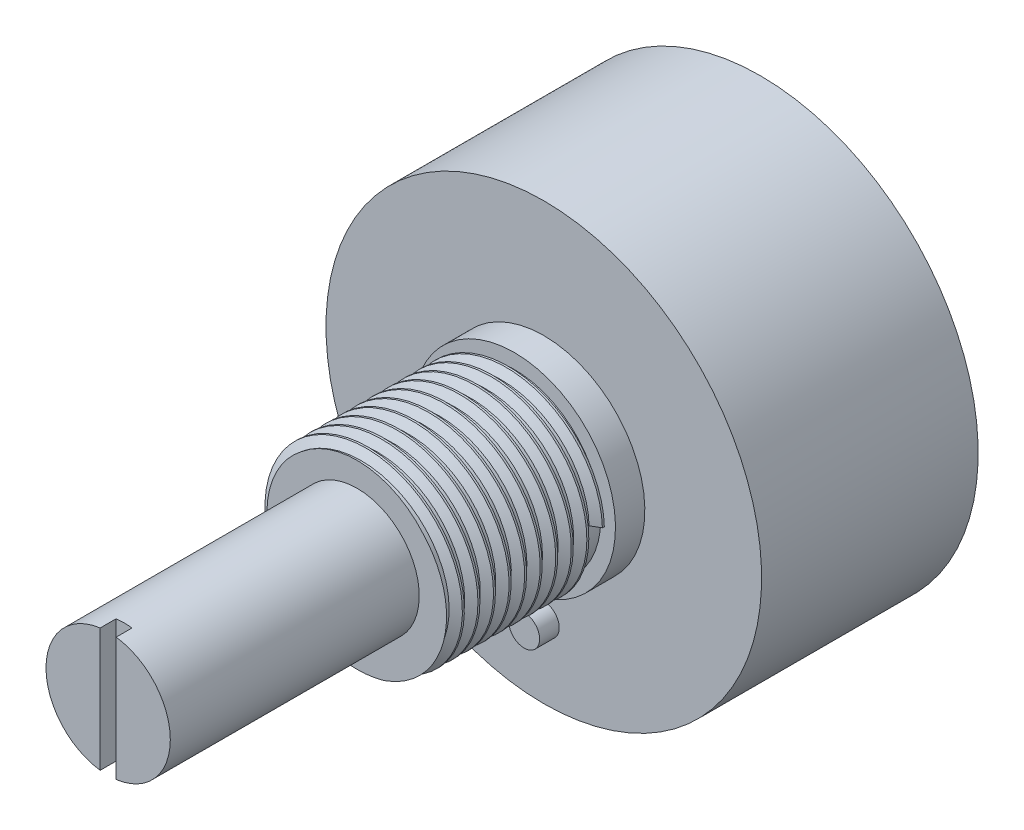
SolidWorks part; units mm, degrees
ref_plane "Front Plane" through (0, 0, 0) normal (0, 0, 1) x (1, 0, 0)
ref_plane "Top Plane" through (0, 0, 0) normal (0, 1, 0) x (1, 0, 0)
ref_plane "Right Plane" through (0, 0, 0) normal (1, 0, 0) x (0, 0, -1)
sketch "Sketch1" plane through (0, 0, 0) normal (1, 0, 0) x (0, 0, -1)
  line L0 (75, 0) -> (-75, 0) construction
  line L1 (-11.049, 11.1125) -> (0, 11.1125)
  line L3 (0, 11.1125) -> (0, 0)
  line L9 (-33.274, 3.1712) -> (-33.274, 0)
  line L10 (-20.574, 3.1712) -> (-33.274, 3.1712)
  line L11 (-20.574, 4.4062) -> (-20.574, 3.1712)
  line L13 (-11.049, 11.1125) -> (-11.049, 5.1562)
  line L14 (-33.274, 0) -> (0, 0)
  line L15 (-11.049, 5.1562) -> (-12.5476, 5.1562)
  line L17 (-12.5476, 5.1562) -> (-12.5476, 4.4062)
  line L20 (-12.5476, 4.4062) -> (-20.574, 4.4062)
  dimension "D1" = 11.1125
  dimension "D2" = 0.75
  dimension "D3" = 5.9563
  dimension "D4" = 12.7
  dimension "D5" = 8.0264
  dimension "D6" = 11.049
  dimension "D7" = 1.4986
  dimension "D8" = 3.1712
revolve "Revolve1" add sketch "Sketch1" angle 360 about L0
thread "Thread1" pitch 0.7937 start angle 0, offset 0, length 0, pitch 0.7937, diameter 8.8124
ref_plane "Plane2" through (4.4062, 0, 12.5476) normal (0, -1, 0) x (1, 0, 0)
sketch "Thread Profile2" plane through (4.4062, 0, 12.5476) normal (0, -1, 0) x (1, 0, 0)
  line L0 (0, 0) -> (0, 0.7937) construction
  line L1 (0, 0) -> (0.4296, 0.248)
  line L2 (0.4296, 0.248) -> (0.4296, 0.3473)
  line L3 (0.4296, 0.3473) -> (0, 0.5953)
  line L4 (0.4296, 0.2977) -> (0, 0.2977) construction
  line L11 (0, 0) -> (0, 0.5953)
  point P2 (0, 0)
  dimension "Pitch" = 0.7937
  dimension "Profile_Angle" = 60
  dimension "Profile_Land" = 0.0992
  dimension "Profile_Height" = 0.4296
sketch "Sketch26" plane through (0, 0, 11.049) normal (0, 0, 1) x (1, 0, 0)
  line L0 (0, 0) -> (0, -7.366) construction
  circle A0 centre (0, -7.366) radius 0.7874
extrude "Boss-Extrude1" add sketch "Sketch26" along normal blind 1
sketch "Sketch27" plane through (0, 0, 33.274) normal (0, 0, 1) x (1, 0, 0)
  line L1 (-0.4064, -3.1712) -> (0.4064, -3.1712)
  line L2 (-0.4064, -3.1712) -> (-0.4064, 3.1712)
  line L3 (-0.4064, 3.1712) -> (0.4064, 3.1712)
  line L4 (0.4064, -3.1712) -> (0.4064, 3.1712)
  line L5 (-0.4064, -3.1712) -> (0.4064, 3.1712) construction
  line L6 (-0.4064, 3.1712) -> (0.4064, -3.1712) construction
  point P0 (0, 0)
  dimension "D1" = 0.8128
extrude "Cut-Extrude1" cut sketch "Sketch27" against normal blind 0.81
